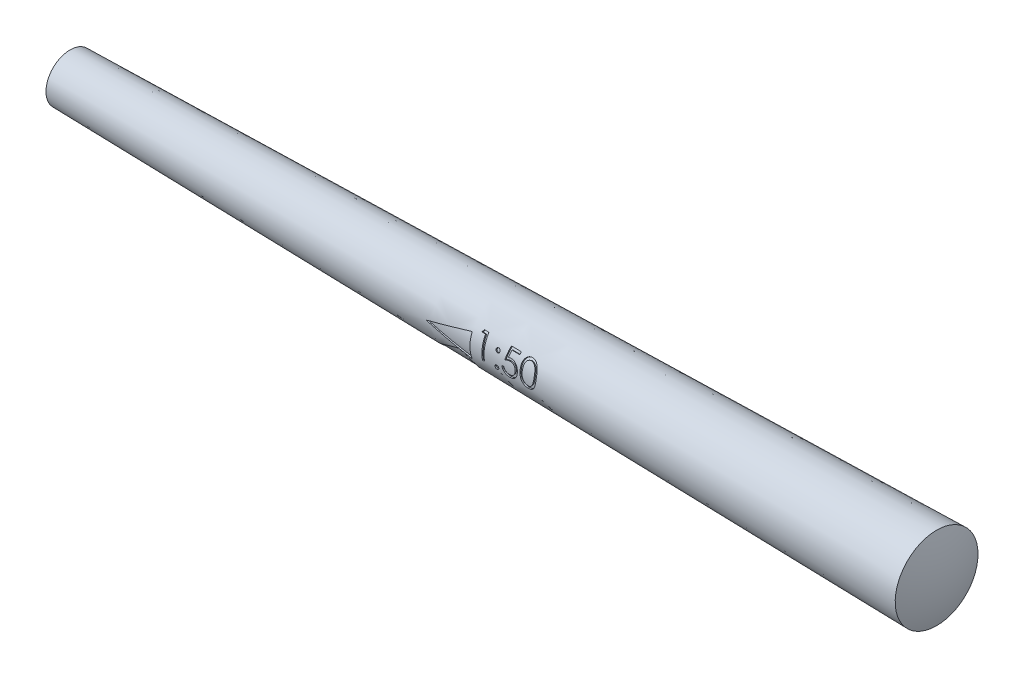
SolidWorks part; units mm, degrees
ref_plane "Front Plane" through (0, 0, 0) normal (0, 0, 1) x (1, 0, 0)
ref_plane "Top Plane" through (0, 0, 0) normal (0, 1, 0) x (1, 0, 0)
ref_plane "Right Plane" through (0, 0, 0) normal (1, 0, 0) x (0, 0, -1)
sketch "Sketch1" plane through (0, 0, 0) normal (1, 0, 0) x (0, 0, -1)
  circle A0 centre (0, 0) radius 1
  dimension "D1" = 2
extrude "Extrude1" add sketch "Sketch1" along normal mid plane 36
draft "Draft1" type of draft neutral plane draft angle 1.146 faces to draft 1 parameters "D1"=1.146
sketch "Sketch2" plane through (0, 0, 0) normal (0, 0, 1) x (1, 0, 0)
  line L0 (-18, 0) -> (-18, 1)
  line L1 (-18, 1) -> (-18, -1) construction
  line L2 (-18, 0) -> (-18.3, 0)
  line L3 (-18.3, 0) -> (-18.3, -1.36) construction
  line L4 (18, 0) -> (18, 1.72)
  line L5 (18, -1.72) -> (18, 1.72) construction
  line L6 (18, 0) -> (18.3, 0)
  line L7 (18.3, 0) -> (18.3, -1.36) construction
  line L8 (-18, -1) -> (18, -1.72) construction
  arc A0 (-18.3, 0) -> (-18, 1) centre (-16.4833, 0) cw
  arc A1 (18.3, 0) -> (18, 1.72) centre (13.2192, 0) ccw
  point P14 (0, -1.36)
revolve "Revolve1" add sketch "Sketch2" angle 360 about L2
sketch "Sketch5" plane through (0, 0, 0) normal (0, 0, 1) x (1, 0, 0)
  line L0 (0, 1.36) -> (0, -1.36) construction
  line L1 (18, 1.72) -> (-18, 1) construction
  line L2 (-18, -1) -> (18, -1.72) construction
ref_plane "Plane2" through (0, 0, 0) normal (-0.02, 0, 0.9998) x (0.9998, 0, 0.02)
sketch "Sketch6" plane through (0, 0, 0) normal (-0.02, 0, 0.9998) x (0.9998, 0, 0.02)
  line L0 (0, 0) -> (0, 0.5)
  line L1 (0, 1.36) -> (0, -1.36) construction
  line L2 (0, 0.5) -> (-1.866, 0)
  line L3 (-1.866, 0) -> (0, -0.5)
  line L4 (0, -0.5) -> (0, 0)
  line L5 (0, -0.25) -> (3, -0.25) construction
  text T0 "1:50" font "Century Gothic" height 1
  dimension "D1" = 1
  dimension "D2" = 30
  dimension "D3" = 3
wrap "Wrap2" sketch "Sketch6" wrap type deboss source sketch "Sketch6" thickness 0.05 parameters "D1"=0.05
equation "\"D2@Sketch2\" = \"D1@Sketch2\""
